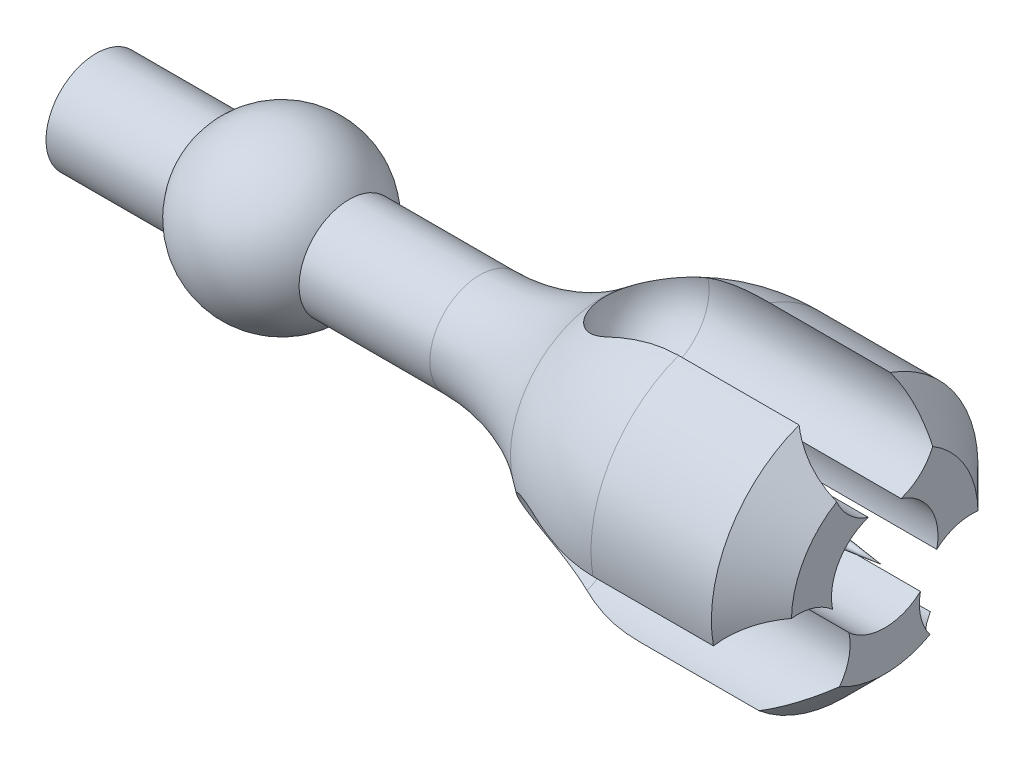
SolidWorks part; units mm, degrees
ref_plane "Plane1" through (0, 0, 0) normal (0, 0, 1) x (1, 0, 0)
ref_plane "Plane2" through (0, 0, 0) normal (0, 1, 0) x (1, 0, 0)
ref_plane "Plane3" through (0, 0, 0) normal (1, 0, 0) x (0, 0, -1)
sketch "Esquisse1" plane through (0, 0, 0) normal (0, 0, 1) x (1, 0, 0)
  line L0 (-250.9044, 12.5) -> (-250.9044, 25)
  line L1 (-265.9044, 0) -> (-265.9044, 27.9857) construction
  line L2 (52.9444, 13.294) -> (52.9444, 7.9481)
  line L3 (-250.9044, 12.5) -> (-147.9856, 12.5)
  line L4 (80, 33.294) -> (110.083, 33.294)
  line L5 (110.083, 33.294) -> (120.083, 23.294)
  line L6 (120.083, 23.294) -> (120.083, 13.294)
  line L7 (120.083, 13.294) -> (52.9444, 13.294)
  line L8 (52.9444, 0) -> (-260.3366, 0)
  line L9 (52.9444, 7.9481) -> (119.1399, 0)
  line L10 (119.1399, 0) -> (52.9444, 0)
  line L11 (-250.9044, 25) -> (-265.9044, 25)
  line L12 (-265.9044, 25) -> (-265.9044, 3.3413)
  line L13 (-149.3376, 0) -> (93.7998, 0) construction
  line L14 (-265.9044, 3.3413) -> (-276.903, 0)
  line L15 (-185.0381, 0) -> (-242.0491, 0) construction
  line L16 (-276.903, 0) -> (-260.3366, 0)
  line L17 (-122.082, 12.5) -> (18.9556, 12.5)
  arc A0 (18.9556, 12.5) -> (49.4778, 22.897) centre (18.9556, 62.5) ccw
  arc A1 (49.4778, 22.897) -> (80, 33.294) centre (80, -16.706) cw
  arc A2 (-122.082, 12.5) -> (-147.9856, 12.5) centre (-135.0338, 0) ccw
  dimension "D4" = 50
  dimension "D5" = 50
  dimension "D10" = 10
  dimension "D11" = 10
revolve "Base-Révolution" add sketch "Esquisse1" angle 360 about L13
sketch "Esquisse3" plane through (0, 0, 0) normal (0, 0, 1) x (1, 0, 0)
  line L0 (40.6426, 25) -> (125.3912, 25) construction
  line L1 (122.4463, 25) -> (122.4463, 38)
  line L2 (122.4463, 38) -> (63.2204, 38)
  line L3 (-149.3376, 0) -> (93.7998, 0) construction
  line L4 (122.4463, 25) -> (50.2204, 25)
  arc A0 (63.2204, 38) -> (50.2204, 25) centre (63.2204, 25) ccw
  dimension "D2" = 13
  dimension "D1" = 25
revolve "Enlever de la matière-Révolution1" cut sketch "Esquisse3" angle 360 about L0
pattern_circular "Répétition circulaire1" count 3 every 120 about axis through (0, 0, 0) along (1, 0, 0) of "Enlever de la matière-Révolution1"
sketch "Esquisse4" plane through (0, 0, 0) normal (0, 0, 1) x (1, 0, 0)
  line L0 (-101.6859, 0) -> (-255.105, 0) construction
  line L1 (-213.6609, 0) -> (-213.6609, 43.305) construction
  line L2 (-149.3376, 0) -> (93.7998, 0) construction
sketch "Esquisse5" plane through (0, 0, 0) normal (0, 0, 1) x (1, 0, 0)
  point P0 (-213.6609, 0)
ref_plane "Plan1" through (-276.903, 0, 0) normal (-1, 0, 0) x (0, 0, 1)
sketch "Esquisse6" plane through (-276.903, 0, 0) normal (-1, 0, 0) x (0, 0, 1)
  circle A0 centre (0, 0) radius 25
extrude "Enlèv. mat.-Extru.1" cut sketch "Esquisse6" against normal blind 200
sketch "Esquisse7" plane through (-111.3896, -6.9536, 0) normal (0, 0, -1) x (-1, 0, 0)
  line L0 (-80.8176, 35.2557) -> (-80.8176, -17.6142) construction
  line L1 (-80.8176, 29.2295) -> (-80.8176, -34.8579) construction
  line L2 (-101.8176, 6.9536) -> (-59.8176, 6.9536)
  arc A0 (-59.8176, 6.9536) -> (-101.8176, 6.9536) centre (-80.8176, 6.9536) ccw
  dimension "D2" = 42
  dimension "D1" = 30.572
revolve "Révolution1" add sketch "Esquisse7" angle 360 about L2
